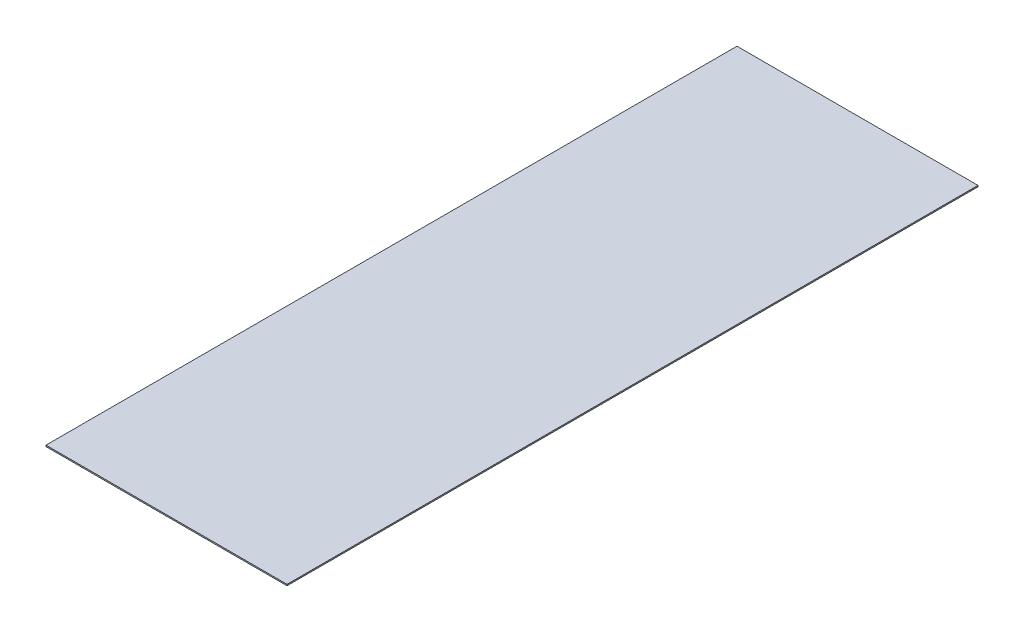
SolidWorks part; units mm, degrees
ref_plane "Front Plane" through (0, 0, 0) normal (0, 0, 1) x (1, 0, 0)
ref_plane "Top Plane" through (0, 0, 0) normal (0, 1, 0) x (1, 0, 0)
ref_plane "Right Plane" through (0, 0, 0) normal (1, 0, 0) x (0, 0, -1)
sketch "Sketch1" plane through (0, 0, 0) normal (0, 1, 0) x (1, 0, 0)
  line L5 (19.05, -76.2) -> (66.675, -76.2)
  line L6 (19.05, -76.2) -> (19.05, 60.325)
  line L7 (19.05, 60.325) -> (66.675, 60.325)
  line L8 (66.675, -76.2) -> (66.675, 60.325)
  dimension "D1" = 136.525
extrude "Boss-Extrude1" add sketch "Sketch1" along normal blind 0.254
